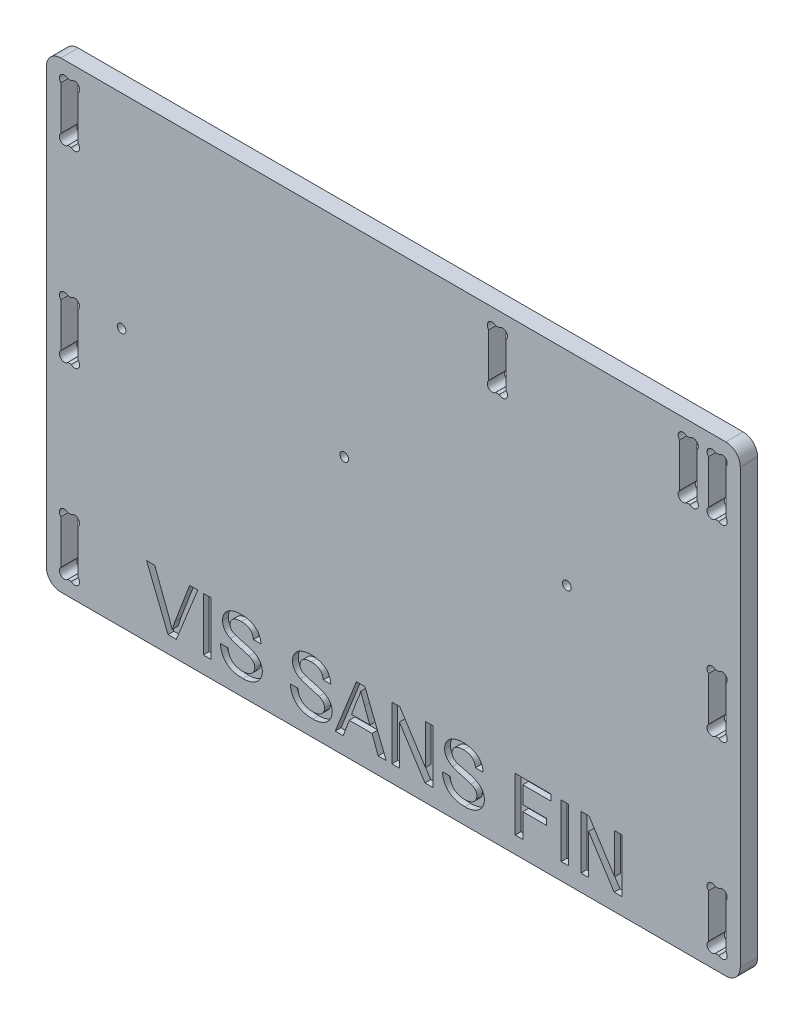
SolidWorks part; units mm, degrees
ref_plane "Plan de face" through (0, 0, 0) normal (0, 0, 1) x (1, 0, 0)
ref_plane "Plan de dessus" through (0, 0, 0) normal (0, 1, 0) x (1, 0, 0)
ref_plane "Plan de droite" through (0, 0, 0) normal (1, 0, 0) x (0, 0, -1)
sketch "Esquisse1" plane through (0, 0, 0) normal (0, 0, 1) x (1, 0, 0)
  line L0 (0, 0) -> (240, 0) construction
  line L1 (0, 0) -> (0, 160) construction
  line L2 (240, 0) -> (240, 160) construction
  line L3 (240, 160) -> (0, 160) construction
  line L4 (7.4042, 25) -> (8.5958, 25)
  line L5 (120, -9.3128) -> (120, 172.2949) construction
  line L6 (254.342, 80) -> (-21.7971, 80) construction
  line L7 (7.4042, 5) -> (8.5958, 5)
  line L8 (5, 22.5958) -> (5, 7.4042)
  line L9 (11, 22.5958) -> (11, 7.4042)
  line L10 (156.5958, 135) -> (155.4042, 135)
  line L11 (159, 137.4042) -> (159, 152.5958)
  line L12 (153, 137.4042) -> (153, 152.5958)
  line L13 (5, 160) -> (235, 160)
  line L14 (0, 155) -> (0, 5)
  line L15 (5, 0) -> (235, 0)
  line L16 (240, 155) -> (240, 5)
  line L17 (156.5958, 155) -> (155.4042, 155)
  line L21 (-13.0446, 89.5) -> (230.271, 89.5) construction
  line L22 (5, 137.4042) -> (5, 152.5958)
  line L23 (7.4042, 155) -> (8.5958, 155)
  line L24 (11, 137.4042) -> (11, 152.5958)
  line L25 (7.4042, 135) -> (8.5958, 135)
  line L27 (7.4042, 90) -> (8.5958, 90)
  line L29 (5, 72.4042) -> (5, 87.5958)
  line L30 (11, 72.4042) -> (11, 87.5958)
  line L31 (7.4042, 70) -> (8.5958, 70)
  line L39 (235, 22.5958) -> (235, 7.4042)
  line L40 (232.5958, 5) -> (231.4042, 5)
  line L41 (229, 22.5958) -> (229, 7.4042)
  line L42 (232.5958, 25) -> (231.4042, 25)
  line L43 (232.5958, 70) -> (231.4042, 70)
  line L44 (229, 72.4042) -> (229, 87.5958)
  line L45 (235, 72.4042) -> (235, 87.5958)
  line L46 (232.5958, 90) -> (231.4042, 90)
  line L47 (232.5958, 135) -> (231.4042, 135)
  line L48 (229, 137.4042) -> (229, 152.5958)
  line L49 (235, 137.4042) -> (235, 152.5958)
  line L50 (232.5958, 155) -> (231.4042, 155)
  line L51 (221.4042, 135) -> (222.5958, 135)
  line L52 (225, 137.4042) -> (225, 152.5958)
  line L53 (219, 137.4042) -> (219, 152.5958)
  line L54 (221.4042, 155) -> (222.5958, 155)
  line L57 (26, 96.9306) -> (26, 106.373) construction
  line L58 (103, 106.373) -> (103, 98.2421) construction
  line L60 (64.5, 93.7832) -> (64.5, 102.701) construction
  arc A0 (5, 160) -> (0, 155) centre (5, 155) ccw
  arc A1 (235, 160) -> (240, 155) centre (235, 155) cw
  arc A2 (235, 0) -> (240, 5) centre (235, 5) ccw
  arc A3 (0, 5) -> (5, 0) centre (5, 5) ccw
  arc A4 (7.4042, 25) -> (5, 22.5958) centre (6.2021, 23.7979) ccw
  arc A5 (8.5958, 25) -> (11, 22.5958) centre (9.7979, 23.7979) cw
  arc A6 (8.5958, 5) -> (11, 7.4042) centre (9.7979, 6.2021) ccw
  arc A7 (7.4042, 5) -> (5, 7.4042) centre (6.2021, 6.2021) cw
  arc A8 (7.4042, 155) -> (5, 152.5958) centre (6.2021, 153.7979) ccw
  arc A9 (8.5958, 155) -> (11, 152.5958) centre (9.7979, 153.7979) cw
  arc A10 (8.5958, 135) -> (11, 137.4042) centre (9.7979, 136.2021) ccw
  arc A11 (7.4042, 135) -> (5, 137.4042) centre (6.2021, 136.2021) cw
  arc A12 (8.5958, 90) -> (11, 87.5958) centre (9.7979, 88.7979) cw
  arc A13 (7.4042, 90) -> (5, 87.5958) centre (6.2021, 88.7979) ccw
  arc A14 (8.5958, 70) -> (11, 72.4042) centre (9.7979, 71.2021) ccw
  arc A15 (7.4042, 70) -> (5, 72.4042) centre (6.2021, 71.2021) cw
  arc A16 (231.4042, 5) -> (229, 7.4042) centre (230.2021, 6.2021) cw
  arc A17 (232.5958, 5) -> (235, 7.4042) centre (233.7979, 6.2021) ccw
  arc A18 (232.5958, 25) -> (235, 22.5958) centre (233.7979, 23.7979) cw
  arc A19 (231.4042, 25) -> (229, 22.5958) centre (230.2021, 23.7979) ccw
  arc A20 (232.5958, 70) -> (235, 72.4042) centre (233.7979, 71.2021) ccw
  arc A21 (231.4042, 70) -> (229, 72.4042) centre (230.2021, 71.2021) cw
  arc A22 (232.5958, 90) -> (235, 87.5958) centre (233.7979, 88.7979) cw
  arc A23 (231.4042, 90) -> (229, 87.5958) centre (230.2021, 88.7979) ccw
  arc A24 (232.5958, 135) -> (235, 137.4042) centre (233.7979, 136.2021) ccw
  arc A25 (231.4042, 135) -> (229, 137.4042) centre (230.2021, 136.2021) cw
  arc A26 (231.4042, 155) -> (229, 152.5958) centre (230.2021, 153.7979) ccw
  arc A27 (232.5958, 155) -> (235, 152.5958) centre (233.7979, 153.7979) cw
  arc A28 (221.4042, 135) -> (219, 137.4042) centre (220.2021, 136.2021) cw
  arc A29 (222.5958, 135) -> (225, 137.4042) centre (223.7979, 136.2021) ccw
  arc A30 (221.4042, 155) -> (219, 152.5958) centre (220.2021, 153.7979) ccw
  arc A31 (222.5958, 155) -> (225, 152.5958) centre (223.7979, 153.7979) cw
  arc A32 (155.4042, 135) -> (153, 137.4042) centre (154.2021, 136.2021) cw
  arc A33 (156.5958, 135) -> (159, 137.4042) centre (157.7979, 136.2021) ccw
  arc A34 (155.4042, 155) -> (153, 152.5958) centre (154.2021, 153.7979) ccw
  arc A35 (156.5958, 155) -> (159, 152.5958) centre (157.7979, 153.7979) cw
  circle A36 centre (26, 89.5) radius 1.5
  circle A37 centre (103, 89.5) radius 1.5
  circle A38 centre (180, 89.5) radius 1.5
  dimension "D1" = 5
extrude "Extrusion1" add sketch "Esquisse1" along normal blind 6
sketch "Esquisse3" plane through (0, 0, 6) normal (0, 0, 1) x (1, 0, 0)
  text T0 "VIS SANS FIN" font "Arial" height in points 72
extrude "Enlèv. mat.-Extru.1" cut sketch "Esquisse3" against normal blind 2
